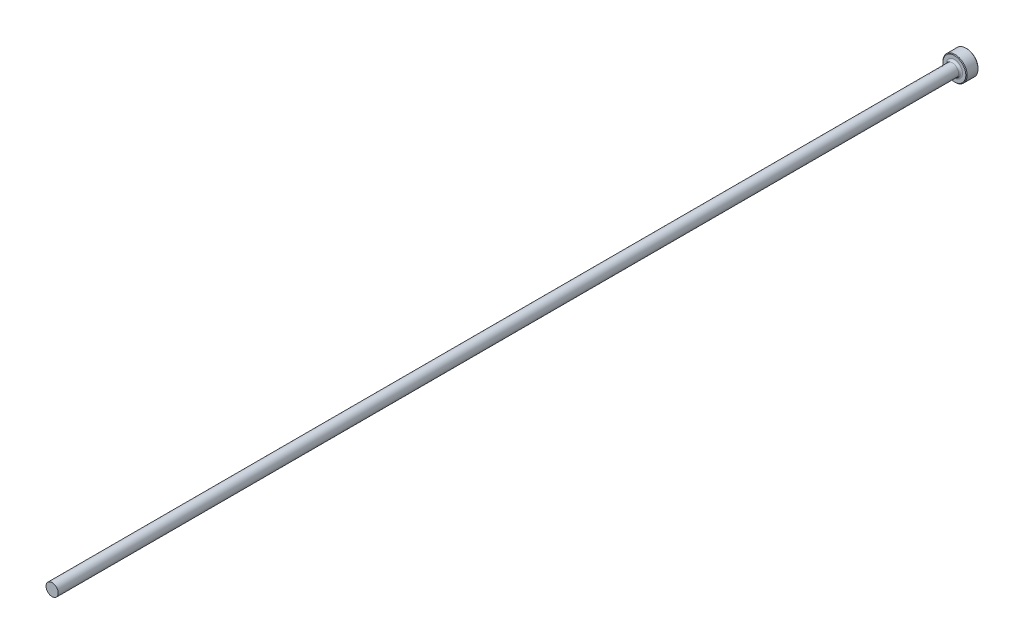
SolidWorks part; units mm, degrees
ref_plane "Front Plane" through (0, 0, 0) normal (0, 0, 1) x (1, 0, 0)
ref_plane "Top Plane" through (0, 0, 0) normal (0, 1, 0) x (1, 0, 0)
ref_plane "Right Plane" through (0, 0, 0) normal (1, 0, 0) x (0, 0, -1)
sketch "Sketch1" plane through (0, 0, 0) normal (1, 0, 0) x (0, 0, -1)
  line L0 (0, 0) -> (0, 4.699)
  line L1 (0, 4.699) -> (-4.7498, 4.699)
  line L2 (-4.7498, 4.699) -> (-4.7498, 3.1432)
  line L3 (-5.5118, 2.3812) -> (-355.6, 2.3812)
  line L4 (-355.6, 2.3812) -> (-355.6, 0)
  line L5 (-355.6, 0) -> (0, 0)
  line L6 (25.4347, 0) -> (-130.6739, 0) construction
  arc A0 (-4.7498, 3.1432) -> (-5.5118, 2.3812) centre (-5.5118, 3.1432) cw
  dimension "D4" = 0.762
  dimension "D1" = 4.7625
  dimension "D2" = 9.398
  dimension "D3" = 4.7498
  dimension "D5" = 355.6
revolve "Revolve1" add sketch "Sketch1" angle 360 about L6
chamfer "Chamfer1" distance 0.254 angle 45 2 edges at (-4.699, 0, 0) (-4.699, 0, 4.7498)
